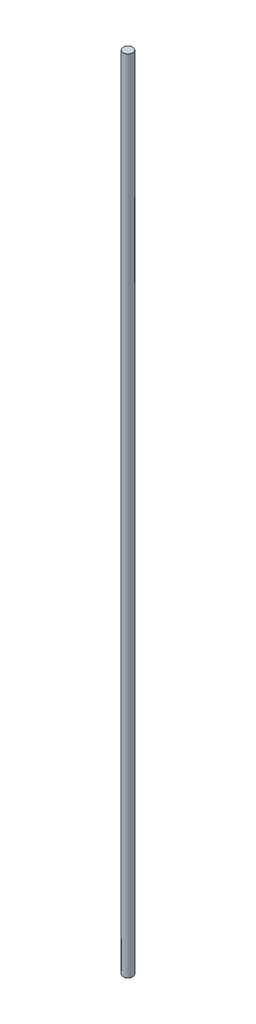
SolidWorks part; units mm, degrees
ref_plane "Front Plane" through (0, 0, 0) normal (0, 0, 1) x (1, 0, 0)
ref_plane "Top Plane" through (0, 0, 0) normal (0, 1, 0) x (1, 0, 0)
ref_plane "Right Plane" through (0, 0, 0) normal (1, 0, 0) x (0, 0, -1)
sketch "Sketch1" plane through (0, 0, 0) normal (0, 1, 0) x (1, 0, 0)
  circle A0 centre (0, 0) radius 9.525
  dimension "D1" = 19.05
extrude "Boss-Extrude1" add sketch "Sketch1" along normal blind 1574.8
